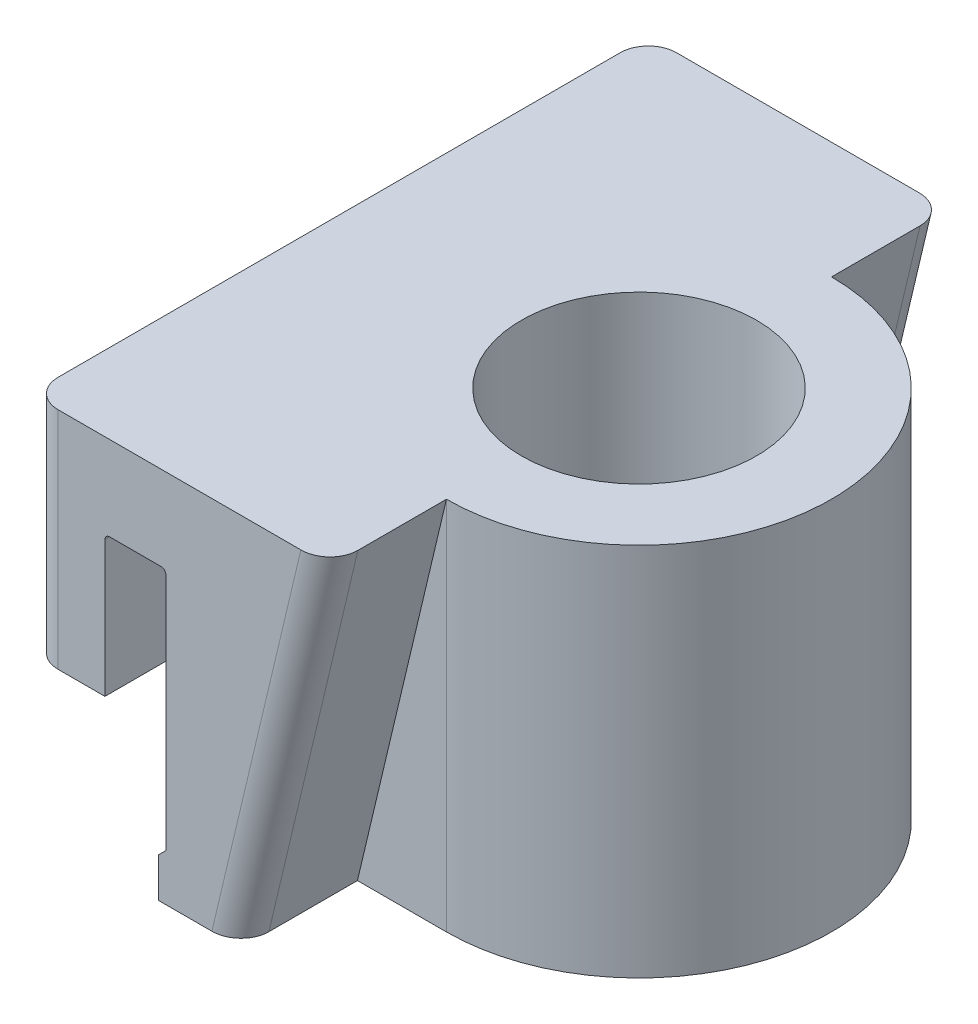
SolidWorks part; units mm, degrees
ref_plane "Front Plane" through (0, 0, 0) normal (0, 0, 1) x (1, 0, 0)
ref_plane "Top Plane" through (0, 0, 0) normal (0, 1, 0) x (1, 0, 0)
ref_plane "Right Plane" through (0, 0, 0) normal (1, 0, 0) x (0, 0, -1)
sketch "Esquisse1" plane through (0, 0, 0) normal (0, 1, 0) x (1, 0, 0)
  line L1 (-32, 33) -> (-32, -33)
  line L3 (0, -20.55) -> (0, -33)
  line L4 (0, -33) -> (-32, -33)
  line L5 (0, 20.55) -> (0, 33)
  line L6 (0, 33) -> (-32, 33)
  arc A0 (0, 20.55) -> (0, -20.55) centre (0, 0) cw
  circle A1 centre (0, 0) radius 12.55
  point P15 (-32, 0)
  dimension "D1" = 25.1
  dimension "D2" = 8
  dimension "D3" = 66
  dimension "D4" = 32
extrude "Boss.-Extru.1" add sketch "Esquisse1" against normal blind 40
sketch "Esquisse2" plane through (0, 0, 33) normal (0, 0, 1) x (1, 0, 0)
  line L0 (-32, -40) -> (0, -40) construction
  line L1 (-24, -40) -> (-17.5, -40)
  line L2 (-24, -40) -> (-24, -9)
  line L3 (-24, -9) -> (-17.5, -9)
  line L4 (-17.5, -40) -> (-17.5, -9)
  line L5 (-32, 0) -> (0, 0) construction
  dimension "D1" = 9
  dimension "D3" = 6.5
  dimension "D4" = 17.5
extrude "Enlèv. mat.-Extru.1" cut sketch "Esquisse2" against normal through all
sketch "Esquisse6" plane through (0, 0, 33) normal (0, 0, 1) x (1, 0, 0)
  line L0 (-32, -40) -> (-32, 0) construction
  line L1 (-32, -24) -> (-24, -24)
  line L2 (-32, -24) -> (-32, -40)
  line L3 (-32, -40) -> (-24, -40)
  line L4 (-24, -24) -> (-24, -40)
  line L5 (-17.5, -9) -> (-24, -9) construction
  dimension "D1" = 15
extrude "Enlèv. mat.-Extru.5" cut sketch "Esquisse6" against normal through all
sketch "Esquisse5" plane through (0, 0, 33) normal (0, 0, 1) x (1, 0, 0)
  line L0 (-9.5, -40) -> (0, 0)
  line L1 (-17.5, -40) -> (0, -40) construction
  line L2 (0, -40) -> (0, 0) construction
  line L3 (0, 0) -> (0, -40)
  line L4 (0, -40) -> (-9.5, -40)
  line L5 (-17.5, -40) -> (-17.5, -9) construction
  dimension "D1" = 8
extrude "Enlèv. mat.-Extru.4" cut sketch "Esquisse5" against normal up to vertex
sketch "Esquisse3" plane through (0, 0, -33) normal (0, 0, 1) x (1, 0, 0)
  line L0 (0, 0) -> (0, -40)
  line L1 (0, -40) -> (-9.5, -40)
  line L2 (-17.5, -40) -> (-9.5, -40) construction
  line L3 (-9.5, -40) -> (0, 0)
  line L4 (0, -40) -> (-9.5, -40) construction
extrude "Enlèv. mat.-Extru.3" cut sketch "Esquisse3" along normal up to vertex
fillet "Congé1" radius 3 4 edges at (-32, -12, -33) (-4.75, -20, -33) (-32, -12, 33) (-4.75, -20, 33)
fillet "Congé2" radius 0.5 2 edges at (-24, -9, 0) (-17.5, -9, 0)
sketch "Esquisse7" plane through (-17.5, 0, 0) normal (-1, 0, 0) x (0, 0, 1)
  line L0 (33, -40) -> (33, -9.5) construction
  line L1 (-33, -40) -> (33, -40)
  line L2 (-33, -40) -> (-33, -35)
  line L3 (-33, -35) -> (33, -35)
  line L4 (33, -40) -> (33, -35)
  dimension "D1" = 5
extrude "Boss.-Extru.2" add sketch "Esquisse7" along normal blind 0.8
chamfer "Chanfrein1" distance 0.8 angle 45 1 edges at (-18.3, -35, 0)
